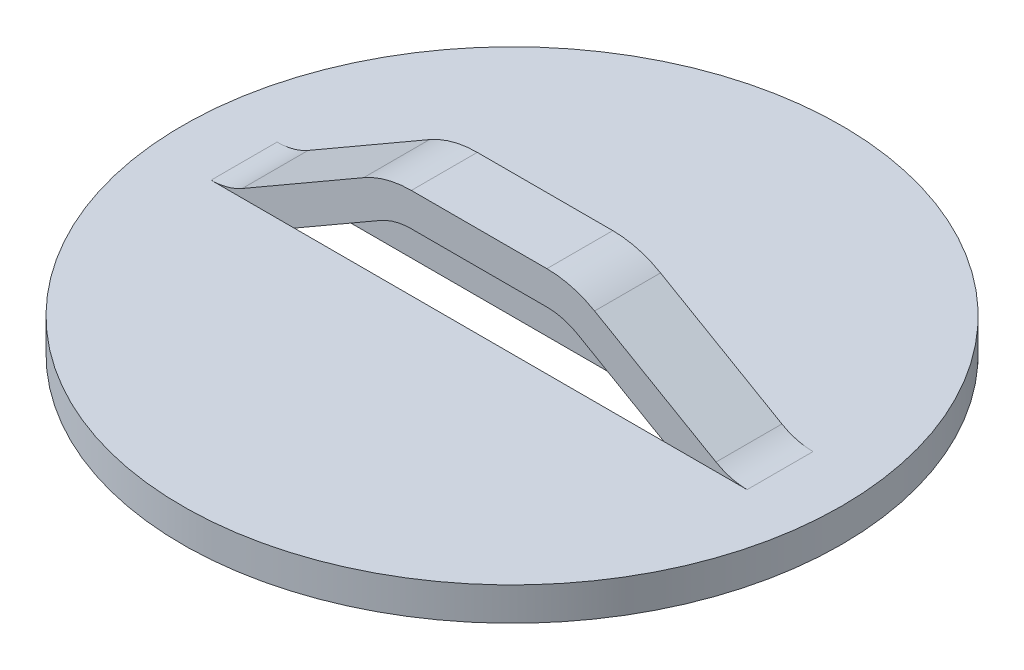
SolidWorks part; units mm, degrees
ref_plane "Front Plane" through (0, 0, 0) normal (0, 0, 1) x (1, 0, 0)
ref_plane "Top Plane" through (0, 0, 0) normal (0, 1, 0) x (1, 0, 0)
ref_plane "Right Plane" through (0, 0, 0) normal (1, 0, 0) x (0, 0, -1)
sketch "Sketch1" plane through (0, 0, 0) normal (0, 0, 1) x (1, 0, 0)
  line L0 (0, 0) -> (2.9652, 0)
  line L1 (4.4638, 0.4015) -> (10.3124, 3.7783)
  line L2 (12.6111, 4.3942) -> (19.1389, 4.3942)
  line L3 (21.4376, 3.7783) -> (27.2862, 0.4015)
  line L4 (28.7848, 0) -> (31.75, 0)
  line L5 (15.875, 4.3942) -> (15.875, -4.9094) construction
  line L6 (0, -1.6002) -> (2.9652, -1.6002)
  line L7 (5.2639, -0.9843) -> (11.1125, 2.3925)
  line L8 (12.6111, 2.794) -> (19.1389, 2.794)
  line L9 (20.6375, 2.3925) -> (26.4861, -0.9843)
  line L10 (28.7848, -1.6002) -> (31.75, -1.6002)
  line L11 (31.75, 0) -> (31.75, -1.6002)
  line L12 (0, 0) -> (0, -1.6002)
  arc A0 (19.1389, 4.3942) -> (21.4376, 3.7783) centre (19.1389, -0.2032) cw
  arc A1 (10.3124, 3.7783) -> (12.6111, 4.3942) centre (12.6111, -0.2032) cw
  arc A2 (27.2862, 0.4015) -> (28.7848, 0) centre (28.7848, 2.9972) ccw
  arc A3 (2.9652, 0) -> (4.4638, 0.4015) centre (2.9652, 2.9972) ccw
  arc A4 (2.9652, -1.6002) -> (5.2639, -0.9843) centre (2.9652, 2.9972) ccw
  arc A5 (11.1125, 2.3925) -> (12.6111, 2.794) centre (12.6111, -0.2032) cw
  arc A6 (19.1389, 2.794) -> (20.6375, 2.3925) centre (19.1389, -0.2032) cw
  arc A7 (26.4861, -0.9843) -> (28.7848, -1.6002) centre (28.7848, 2.9972) ccw
  dimension "D4" = 4.5974
  dimension "D6" = 2.9972
  dimension "D1" = 31.75
  dimension "D2" = 4.3942
  dimension "D3" = 30
  dimension "D5" = 6.5278
  dimension "D7" = 1.6002
extrude "Boss-Extrude1" add sketch "Sketch1" against normal blind 3.175
sketch "Sketch2" plane through (0, -1.6002, 0) normal (0, -1, 0) x (1, 0, 0)
  line L0 (15.875, 0) -> (15.875, -3.175) construction
  line L1 (12.6111, 0) -> (19.1389, 0) construction
  line L2 (12.6111, -3.175) -> (19.1389, -3.175) construction
  line L4 (2.9652, 0) -> (28.7848, 0)
  line L5 (2.9652, 0) -> (2.9652, -3.175)
  line L6 (2.9652, -3.175) -> (28.7848, -3.175)
  line L7 (28.7848, 0) -> (28.7848, -3.175)
  circle A0 centre (15.875, -1.5875) radius 15.875
extrude "Boss-Extrude2" add sketch "Sketch2" against normal up to vertex
other "DeleteFace1"
